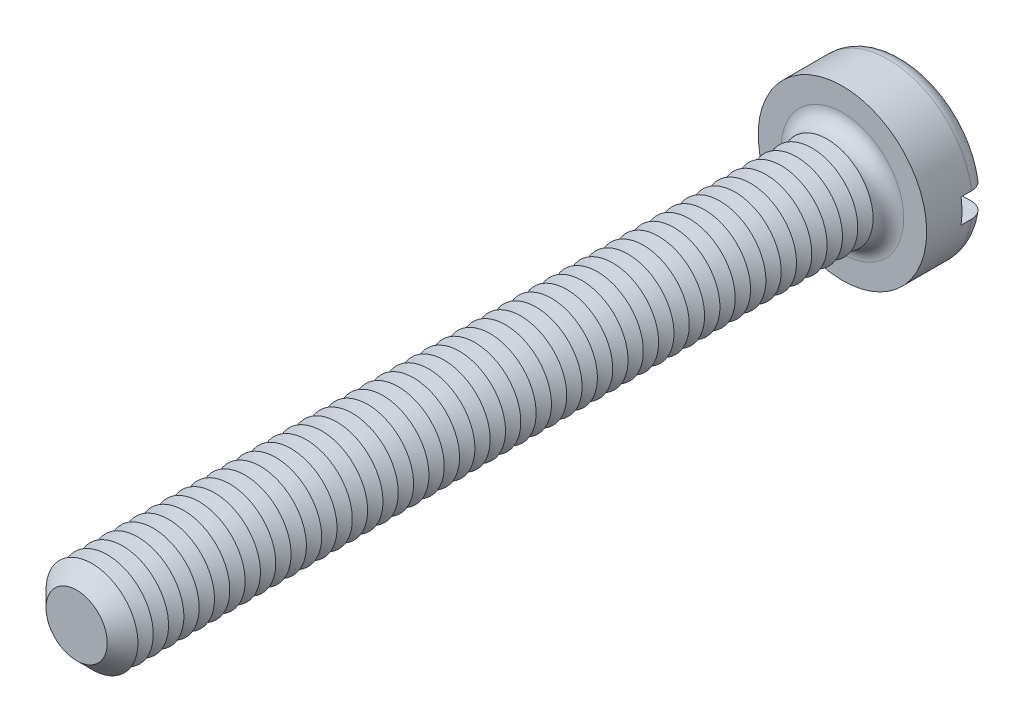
SolidWorks part; units mm, degrees
ref_plane "Front Plane" through (0, 0, 0) normal (0, 0, 1) x (1, 0, 0)
ref_plane "Top Plane" through (0, 0, 0) normal (0, 1, 0) x (1, 0, 0)
ref_plane "Right Plane" through (0, 0, 0) normal (1, 0, 0) x (0, 0, -1)
sketch "Sketch3" plane through (0, 0, 0) normal (0, 0, 1) x (1, 0, 0)
  circle A0 centre (0, 0) radius 2.75
  dimension "D1" = 5.5
extrude "Boss-Extrude2" add sketch "Sketch3" against normal blind 2
sketch "Sketch4" plane through (0, 0, 0) normal (0, 0, 1) x (1, 0, 0)
  circle A0 centre (0, 0) radius 1.5
  dimension "D1" = 3
extrude "Boss-Extrude3" add sketch "Sketch4" along normal blind 25
fillet "Fillet1" radius 0.5 2 edges at (2.75, 0, -2) (1.5, 0, 0)
chamfer "Chamfer1" distance 0.5 angle 45 1 edges at (1.5, 0, 25)
sketch "Sketch5" plane through (0, 0, 0) normal (1, 0, 0) x (0, 0, -1)
  line L0 (1.6944, 0) -> (-7.6738, 0) construction
sketch "Sketch6" plane through (0, 0, 0) normal (1, 0, 0) x (0, 0, -1)
  line L0 (-0.5, 1.5) -> (-0.75, 1.067)
  line L1 (-0.75, 1.067) -> (-1, 1.5)
  line L2 (-0.5, 1.5) -> (-24.5, 1.5) construction
  line L3 (-1, 1.5) -> (-0.5, 1.5)
  dimension "D1" = 0.5
revolve "Cut-Revolve1" cut sketch "Sketch6" angle 360 about L0
pattern_linear "LPattern1" count 48 spacing 0.5 along (0, 0, 1) of "Cut-Revolve1"
sketch "Sketch8" plane through (0, 0, -2) normal (0, 0, -1) x (-1, 0, 0)
  line L1 (2.75, -0.4) -> (-2.75, -0.4)
  line L2 (2.75, -0.4) -> (2.75, 0.4)
  line L3 (2.75, 0.4) -> (-2.75, 0.4)
  line L4 (-2.75, -0.4) -> (-2.75, 0.4)
  line L5 (2.75, -0.4) -> (-2.75, 0.4) construction
  line L6 (2.75, 0.4) -> (-2.75, -0.4) construction
  point P0 (0, 0)
  dimension "D1" = 5.5
  dimension "D2" = 0.8
extrude "Cut-Extrude1" cut sketch "Sketch8" against normal blind 0.85
